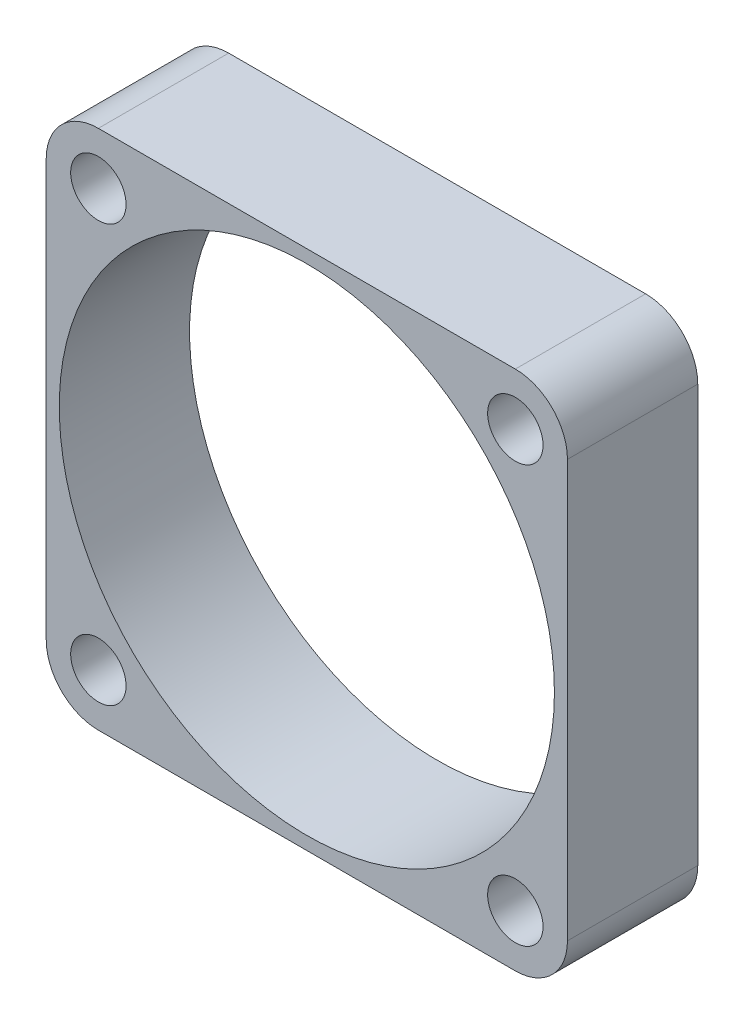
SolidWorks part; units mm, degrees
ref_plane "Plan de face" through (0, 0, 0) normal (0, 0, 1) x (1, 0, 0)
ref_plane "Plan de dessus" through (0, 0, 0) normal (0, 1, 0) x (1, 0, 0)
ref_plane "Plan de droite" through (0, 0, 0) normal (1, 0, 0) x (0, 0, -1)
sketch "Esquisse1" plane through (0, 0, 0) normal (0, 0, 1) x (1, 0, 0)
  line L0 (-58.638, 36) -> (-18.638, -4) construction
  line L1 (-58.638, 36) -> (-18.638, 36)
  line L2 (-58.638, 36) -> (-58.638, -4)
  line L3 (-58.638, -4) -> (-18.638, -4)
  line L4 (-18.638, 36) -> (-18.638, -4)
  line L5 (-38.638, 16) -> (-22.638, 16) construction
  line L6 (-22.638, 16) -> (-22.638, 32) construction
  line L7 (-22.638, 32) -> (-54.638, 32) construction
  line L8 (-54.638, 32) -> (-54.638, 0) construction
  line L9 (-54.638, 0) -> (-22.638, 0) construction
  line L10 (-22.638, 0) -> (-22.638, 16) construction
  circle A0 centre (-38.638, 16) radius 19
  circle A1 centre (-54.638, 32) radius 2.125
  circle A2 centre (-22.638, 32) radius 2.125
  circle A3 centre (-54.638, 0) radius 2.125
  circle A4 centre (-22.638, 0) radius 2.125
  dimension "D3" = 32
  dimension "D1" = 40
  dimension "D2" = 40
  dimension "D4" = 32
  dimension "D5" = 16
  dimension "D6" = 16
extrude "Boss.-Extru.1" add sketch "Esquisse1" along normal blind 10
fillet "Congé1" radius 4 4 edges at (-58.638, -4, 5) (-18.638, -4, 5) (-18.638, 36, 5) (-58.638, 36, 5)
